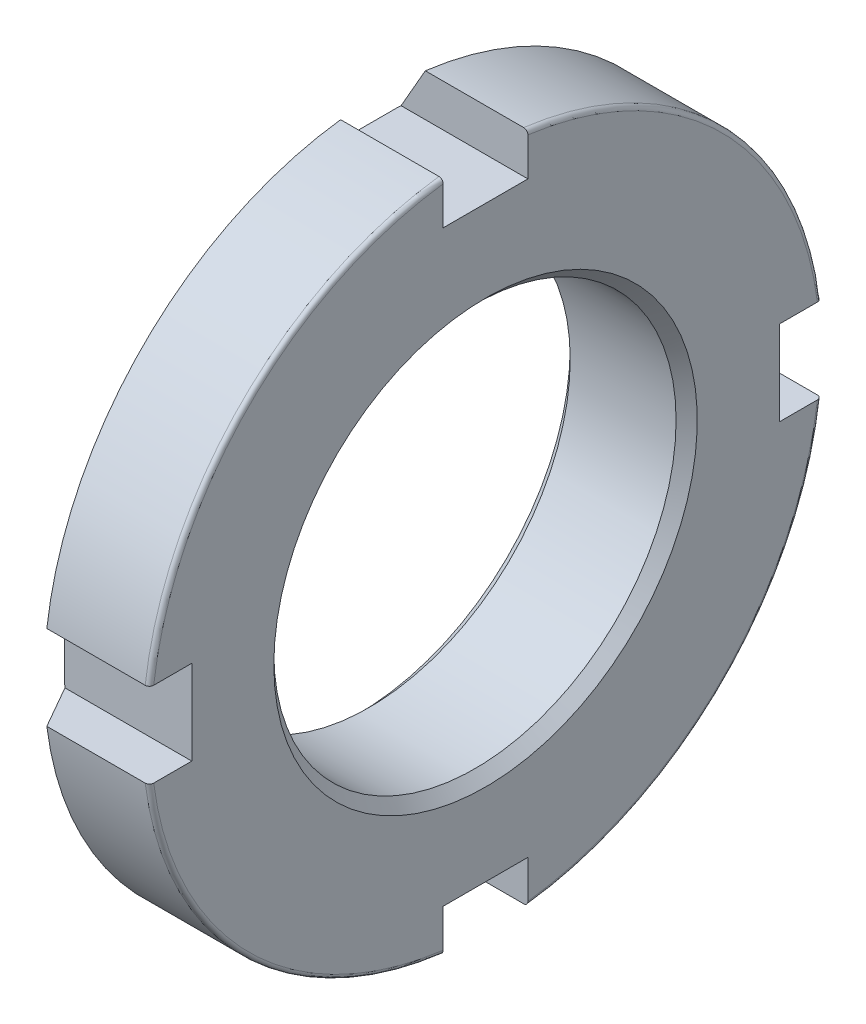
SolidWorks part; units mm, degrees
ref_plane "Plan1" through (0, 0, 0) normal (0, 0, 1) x (1, 0, 0)
ref_plane "Plan2" through (0, 0, 0) normal (0, 1, 0) x (1, 0, 0)
ref_plane "Plan3" through (0, 0, 0) normal (1, 0, 0) x (0, 0, -1)
sketch "Esquisse1" plane through (0, 0, 0) normal (0, 0, 1) x (1, 0, 0)
  line L0 (1.1547, 16) -> (0, 14)
  line L1 (1.1547, 16) -> (5.8, 16)
  line L2 (0, 14) -> (0, 9.5)
  line L3 (0, 9.5) -> (6, 9.5)
  line L4 (6, 15.8) -> (6, 9.5)
  line L5 (0, 0) -> (6, 0) construction
  arc A0 (6, 15.8) -> (5.8, 16) centre (5.8, 15.8) ccw
  dimension "D6" = 0.2
  dimension "D1" = 6
  dimension "D2" = 19
  dimension "D3" = 32
  dimension "D4" = 28
  dimension "D5" = 30
revolve "Base-Révolution" add sketch "Esquisse1"
chamfer "Chanfrein1" distance 0.5 angle 45
sketch "Esquisse2" plane through (6, 0, 0) normal (1, 0, 0) x (0, 0, -1)
  line L0 (0, 13.8745) -> (0, 0) construction
  line L1 (-2, 16) -> (2, 16)
  line L2 (-2, 16) -> (-2, 13.8745)
  line L3 (-2, 13.8745) -> (2, 13.8745)
  line L4 (2, 16) -> (2, 13.8745)
  circle A1 centre (0, 0) radius 16 construction
  point P9 (-2, 15.8745)
  dimension "D1" = 4
  dimension "D2" = 2
extrude "Enlèv. mat.-Extru.1" cut sketch "Esquisse2" against normal through all
pattern_circular "Répétition circulaire1" count 4 over 360
